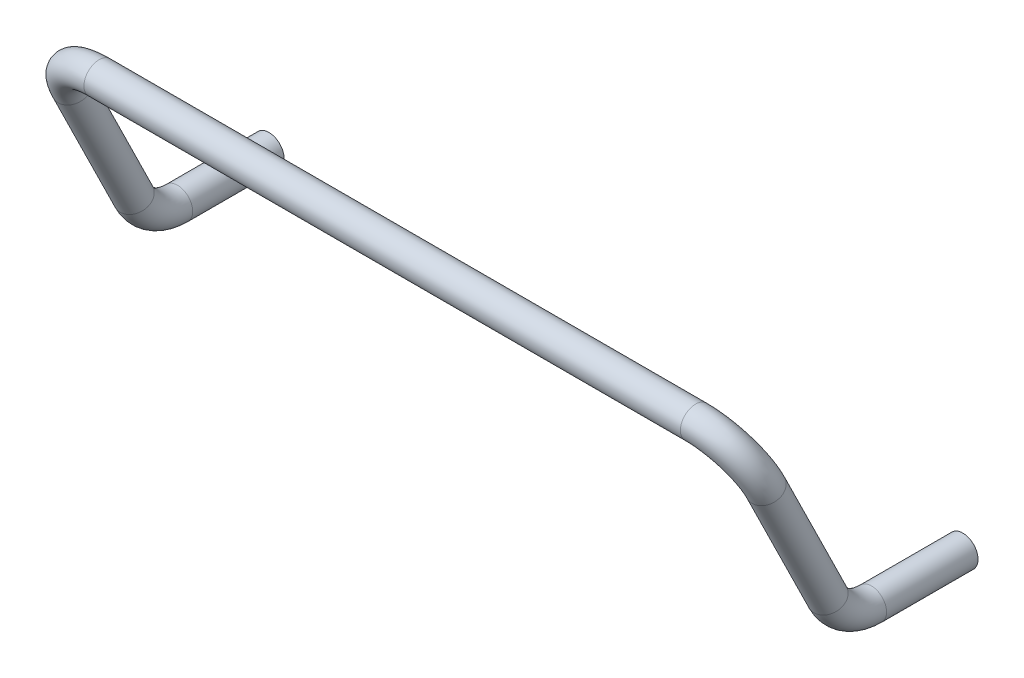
SolidWorks part; units mm, degrees
ref_plane "Face" through (0, 0, 0) normal (0, 0, 1) x (1, 0, 0)
ref_plane "Dessus" through (0, 0, 0) normal (0, 1, 0) x (1, 0, 0)
ref_plane "Droite" through (0, 0, 0) normal (1, 0, 0) x (0, 0, -1)
sketch "Esquisse2" plane through (0, 0, 0) normal (0, 0, 1) x (1, 0, 0)
  circle A0 centre (0, 0) radius 11
  circle A1 centre (0, 0) radius 12.5
  dimension "D1" = 25
  dimension "D2" = 22
sketch3d "Esquisse3D1"
  line L0 (0, 0, 0) -> (0, 0, 75.1066)
  line L1 (0, 22.3341, 110.9941) -> (0, 125.6064, 161.8306)
  line L2 (40, 161.494, 179.4965) -> (285, 161.494, 179.4965)
  arc A0 (0, 22.3341, 110.9941) -> (0, 0, 75.1066) centre (0, 40, 75.1066) ccw
  arc A1 (0, 125.6064, 161.8306) -> (40, 161.494, 179.4965) centre (40, 125.6064, 161.8306) ccw
  point P7 (0, 0, 100)
  point P8 (40, 40, 75.1066)
  point P11 (0, 161.494, 179.4965)
  point P12 (40, 143.2723, 125.943)
  dimension "D3" = 40
  dimension "D4" = 40
  dimension "D1" = 100
  dimension "D2" = 285
  dimension "D5" = 180
sweep "Base-Balayage" add profiles "Esquisse2" path "Esquisse3D1"
mirror "Tout symétriser1"
ref_plane "Plan1" through (485, 0, 0) normal (-1, 0, 0) x (0, 0, 1)
sketch "Esquisse4" plane through (485, 0, 0) normal (-1, 0, 0) x (0, 0, 1)
  line L2 (179.4965, 161.494) -> (187.4206, 168.5444)
  line L3 (179.4965, 161.494) -> (172.7577, 169.0679)
  point P0 (179.4965, 161.494)
ref_plane "Plan2" through (80, 0, 0) normal (-1, 0, 0) x (0, 0, 1)
sketch "Esquisse5" plane through (80, 0, 0) normal (-1, 0, 0) x (0, 0, 1)
  line L2 (179.4965, 161.494) -> (172.2321, 169.6586)
  line L3 (179.4965, 161.494) -> (187.191, 168.34)
  point P0 (179.4965, 161.494)
